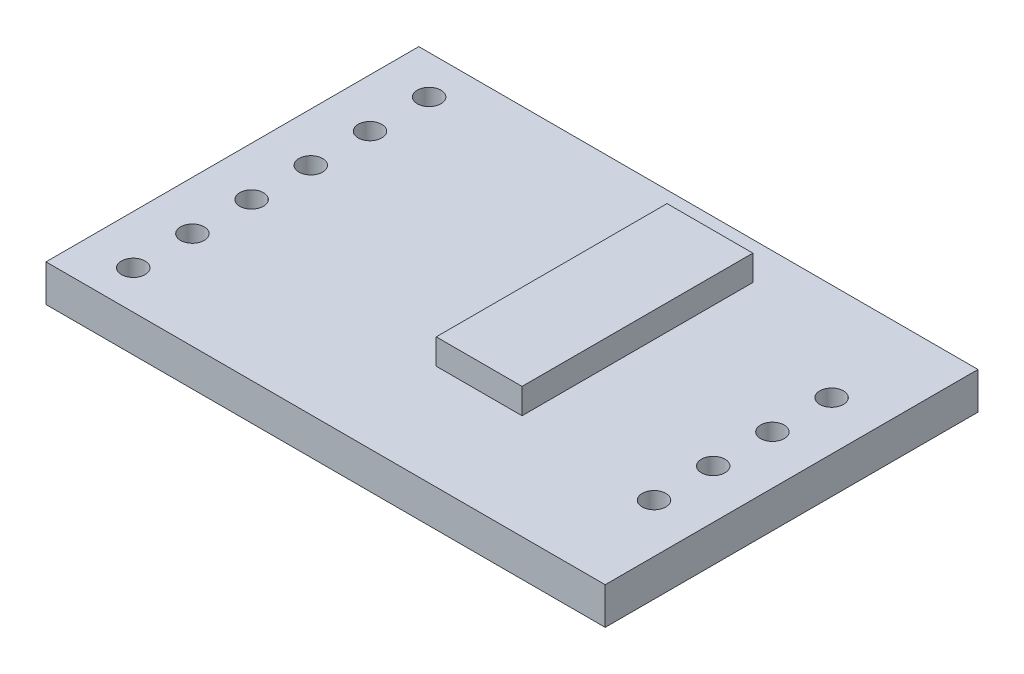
SolidWorks part; units mm, degrees
ref_plane "Front Plane" through (0, 0, 0) normal (0, 0, 1) x (1, 0, 0)
ref_plane "Top Plane" through (0, 0, 0) normal (0, 1, 0) x (1, 0, 0)
ref_plane "Right Plane" through (0, 0, 0) normal (1, 0, 0) x (0, 0, -1)
sketch "Sketch1" plane through (0, 0, 0) normal (0, 1, 0) x (1, 0, 0)
  line L1 (-12, -8) -> (12, -8)
  line L2 (-12, -8) -> (-12, 8)
  line L3 (-12, 8) -> (12, 8)
  line L4 (12, -8) -> (12, 8)
  line L5 (-12, -8) -> (12, 8) construction
  line L6 (-12, 8) -> (12, -8) construction
  line L7 (-9.906, -6.35) -> (9.906, -6.35) construction
  line L8 (-9.906, -6.35) -> (-9.906, 6.35) construction
  line L9 (-9.906, 6.35) -> (9.906, 6.35) construction
  line L10 (9.906, -6.35) -> (9.906, 6.35) construction
  line L11 (-9.906, -6.35) -> (9.906, 6.35) construction
  line L12 (-9.906, 6.35) -> (9.906, -6.35) construction
  circle A0 centre (-9.906, -6.35) radius 0.508
  circle A1 centre (9.906, -6.35) radius 0.508
  circle A2 centre (9.906, -3.81) radius 0.508
  circle A3 centre (9.906, -1.27) radius 0.508
  circle A4 centre (9.906, 1.27) radius 0.508
  circle A5 centre (9.906, 3.81) radius 0.508
  circle A6 centre (9.906, 6.35) radius 0.508
  circle A7 centre (-9.906, -3.81) radius 0.508
  circle A8 centre (-9.906, -1.27) radius 0.508
  circle A9 centre (-9.906, 1.27) radius 0.508
  circle A10 centre (-9.906, 3.81) radius 0.508
  circle A11 centre (-9.906, 6.35) radius 0.508
  point P0 (0, 0)
  point P6 (0, 0)
  dimension "D5" = 1.016
  dimension "D1" = 16
  dimension "D2" = 24
  dimension "D3" = 19.812
  dimension "D4" = 12.7
  dimension "D6" = 2
  dimension "D7" = 6
extrude "Boss-Extrude1" add sketch "Sketch1" along normal blind 1.5875
sketch "Sketch2" plane through (0, 1.5875, 0) normal (0, 1, 0) x (1, 0, 0)
  line L0 (12, 8) -> (-12, 8) construction
  line L1 (0.254, -3.5062) -> (3.937, -3.5062)
  line L2 (0.254, -3.5062) -> (0.254, 6.3998)
  line L3 (0.254, 6.3998) -> (3.937, 6.3998)
  line L4 (3.937, -3.5062) -> (3.937, 6.3998)
  line L5 (0.254, -3.5062) -> (3.937, 6.3998) construction
  line L6 (0.254, 6.3998) -> (3.937, -3.5062) construction
  circle A0 centre (-9.906, 1.27) radius 0.508 construction
  point P0 (2.0955, 1.4468)
  dimension "D3" = 10.16
  dimension "D1" = 3.683
  dimension "D2" = 9.906
  dimension "D4" = 1.6002
extrude "Boss-Extrude2" add sketch "Sketch2" along normal blind 1.0922 separate body
sketch "Sketch3" plane through (0, 1.5875, 0) normal (0, 1, 0) x (1, 0, 0)
  text T0 "<b>E+</b>  <b>E-</b>  <b>A-</b>  <b>A+</b>  <b>B-</b>  <b>B+</b>" font "Calibri" height 1.016
  text T1 "<b>GND</b>  <b>DT</b>  <b>CK</b>  <b>VCC</b>" font "Century Gothic" height 1.016
  text T2 "HX711" font "Calibri" height in points 10
